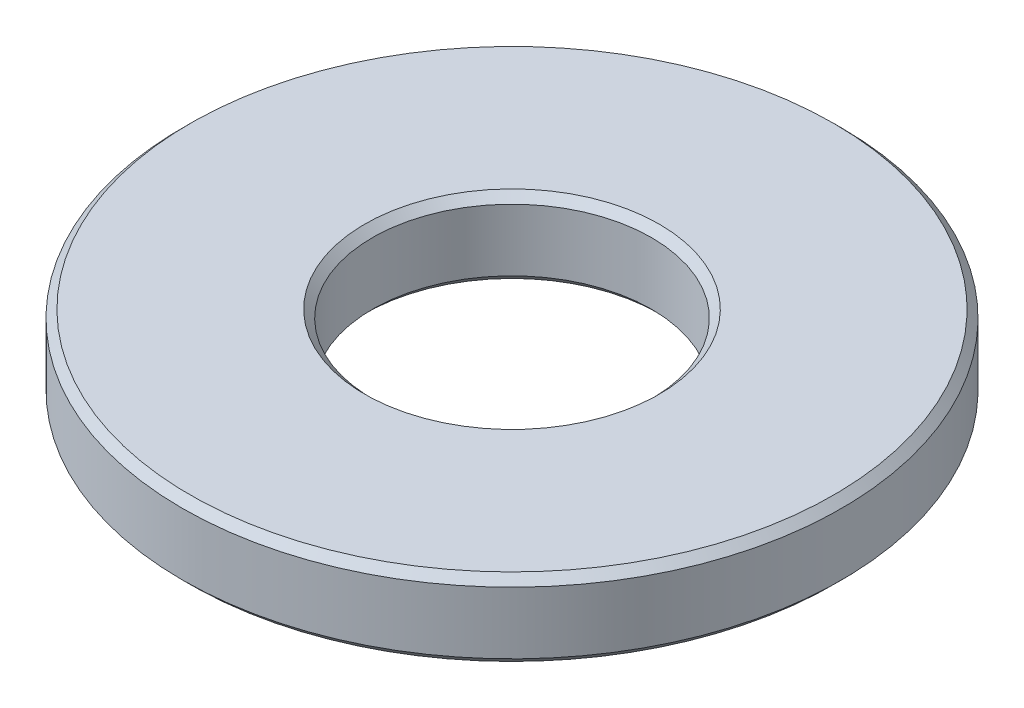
SolidWorks part; units mm, degrees
ref_plane "Face" through (0, 0, 0) normal (0, 0, 1) x (1, 0, 0)
ref_plane "Dessus" through (0, 0, 0) normal (0, 1, 0) x (1, 0, 0)
ref_plane "Droite" through (0, 0, 0) normal (1, 0, 0) x (0, 0, -1)
sketch "Esquisse1" plane through (0, 0, 0) normal (0, 0, 1) x (1, 0, 0)
  line L0 (0, 0) -> (0, 20) construction
  line L1 (36, 2) -> (36, 18)
  line L2 (38, 20) -> (83, 20)
  line L3 (85, 18) -> (85, 2)
  line L4 (83, 0) -> (38, 0)
  line L5 (36, 18) -> (38, 20)
  line L6 (83, 20) -> (85, 18)
  line L7 (85, 2) -> (83, 0)
  line L8 (38, 0) -> (36, 2)
  point P3 (36, 0)
  point P4 (36, 20)
  point P6 (85, 20)
  point P7 (85, 0)
  dimension "D1" = 20
  dimension "D2" = 72
  dimension "D3" = 170
revolve "Révolution1" add sketch "Esquisse1" angle 360 about L0
